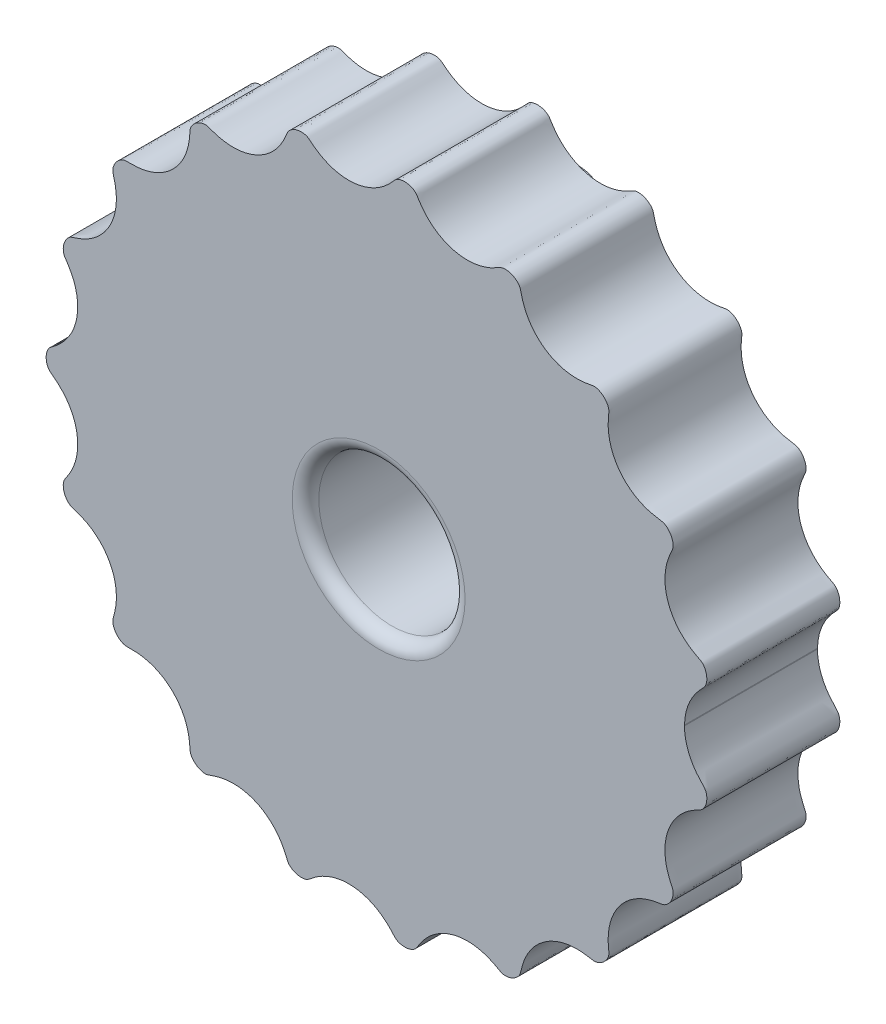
SolidWorks part; units mm, degrees
ref_plane "Ebene vorne" through (0, 0, 0) normal (0, 0, 1) x (1, 0, 0)
ref_plane "Ebene oben" through (0, 0, 0) normal (0, 1, 0) x (1, 0, 0)
ref_plane "Ebene rechts" through (0, 0, 0) normal (1, 0, 0) x (0, 0, -1)
sketch "Skizze1" plane through (0, 0, 0) normal (0, 0, 1) x (1, 0, 0)
  circle A0 centre (0, 0) radius 25
  dimension "D1" = 50
extrude "Aufsatz-Linear austragen1" add sketch "Skizze1" along normal blind 10 contours A0
sketch "Skizze3" plane through (0, 0, 10) normal (0, 0, 1) x (1, 0, 0)
  circle A0 centre (0, 25) radius 0.5
  circle A1 centre (0, 0) radius 25 construction
extrude "Schnitt-Linear austragen1" cut sketch "Skizze3" against normal up to next contours A0
pattern_circular "Kreismuster3" [suppressed] count 30 over 360
sketch "Skizze9" plane through (0, 0, 10) normal (0, 0, 1) x (1, 0, 0)
  line L0 (23.0004, 0.0609) -> (23, 0)
  spline S0 degree 4 number of poles 711 (21.8349, 10.4363) -> (21.8113, -10.3736) construction
  spline S1 degree 4 number of poles 634 (23, 0) -> (23.0004, 0.0609)
extrude "Schnitt-Linear austragen6" cut sketch "Skizze9" against normal blind 10 flip side to cut
sketch "Skizze21" plane through (0, 0, 0) normal (0, 0, -1) x (-1, 0, 0)
  circle A0 centre (0, 0) radius 5.5
  dimension "D1" = 11
extrude "Schnitt-Linear austragen11" cut sketch "Skizze21" against normal blind 10
sketch "Skizze22" plane through (0, 0, 0) normal (0, 0, -1) x (-1, 0, 0)
  circle A0 centre (0, 0) radius 15
  circle A1 centre (0, 15) radius 2.5
  circle A2 centre (12.9904, -7.5) radius 2.5
  circle A3 centre (-12.9904, -7.5) radius 2.5
  point P12 (0, 0)
  dimension "D1" = 3
  dimension "D2" = 5
extrude "Aufsatz-Linear austragen2" add sketch "Skizze22" along normal blind 5 contours A1 | A3 | A2
fillet "Verrundung1" radius 1 2 edges at (-5.5, 0, 0) (-5.5, 0, 10)
